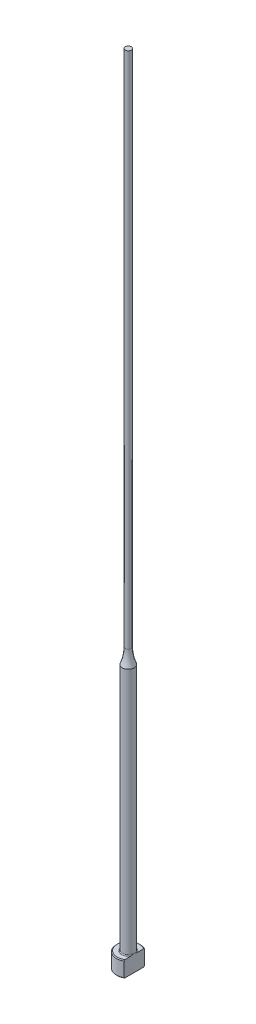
SolidWorks part; units mm, degrees
ref_plane "Front Plane" through (0, 0, 0) normal (0, 0, 1) x (1, 0, 0)
ref_plane "Top Plane" through (0, 0, 0) normal (0, 1, 0) x (1, 0, 0)
ref_plane "Right Plane" through (0, 0, 0) normal (1, 0, 0) x (0, 0, -1)
sketch "Sketch1" plane through (0, 0, 0) normal (0, 0, 1) x (1, 0, 0)
  line L0 (0, 259.9588) -> (0, -15.1925) construction
  line L1 (0, 0) -> (-3, 0)
  line L2 (-3, 0) -> (-3, 4)
  line L3 (-3, 4) -> (-1.5, 4)
  line L4 (-0.75, 70) -> (-0.75, 200)
  line L5 (-0.75, 200) -> (0, 200)
  line L6 (0, 200) -> (0, 0)
  line L7 (-1.5, 4) -> (-1.5, 66.2003)
  arc A0 (-1.5, 66.2003) -> (-0.75, 70) centre (-10.75, 70) ccw
  point P13 (-1.5, 0)
  dimension "D1" = 10
  dimension "L" = 200
  dimension "H" = 6
  dimension "T" = 4
  dimension "D" = 1.5
  dimension "B" = 3
  dimension "S" = 70
revolve "Revolve1" add sketch "Sketch1" angle 360 about L0
chamfer "Chamfer1" distance 0.2 angle 45 2 edges at (0, 4, 3) (0, 0, 3)
fillet "Fillet1" radius 0.2 1 edges at (0, 4, 1.5)
sketch "Sketch2" plane through (0, 0, 0) normal (0, 1, 0) x (1, 0, 0)
  line L0 (1.5, -2.5981) -> (1.5, 2.5981)
  circle A0 centre (0, 0) radius 3 construction
  arc A1 (1.5, -2.5981) -> (1.5, 2.5981) centre (0, 0) ccw
  circle A2 centre (0, 0) radius 1.5 construction
extrude "Keyed Head" cut sketch "Sketch2" along normal through all
